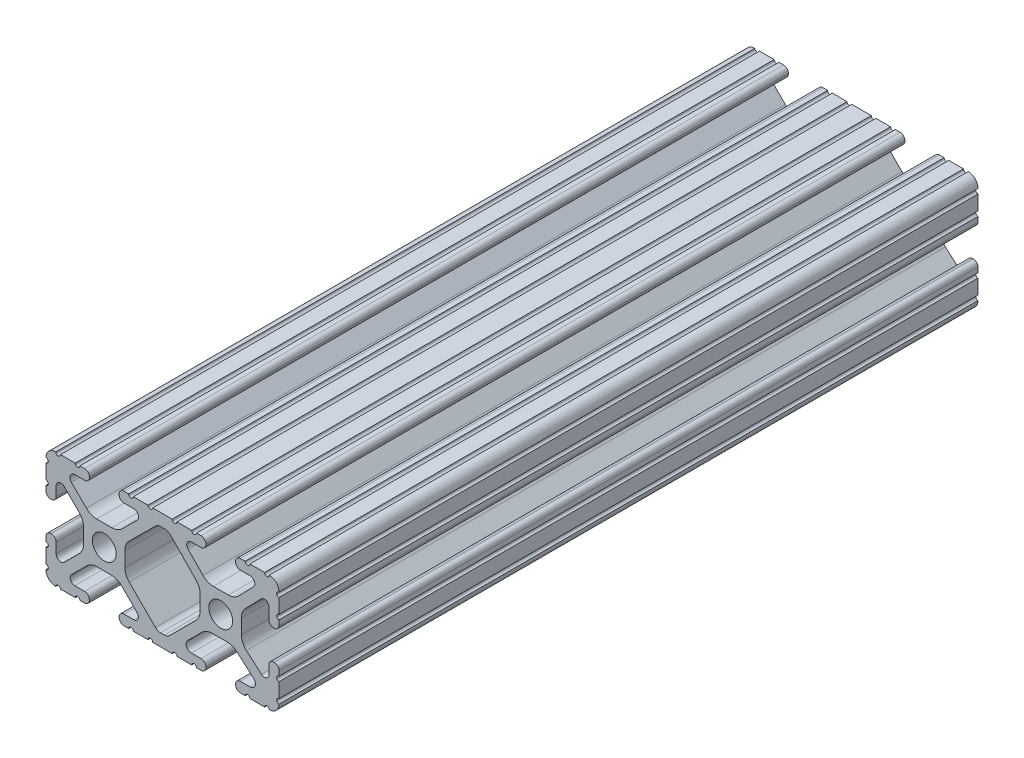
SolidWorks part; units mm, degrees
ref_plane "Front" through (0, 0, 0) normal (0, 0, 1) x (1, 0, 0)
ref_plane "Top" through (0, 0, 0) normal (0, 1, 0) x (1, 0, 0)
ref_plane "Right" through (0, 0, 0) normal (1, 0, 0) x (0, 0, -1)
sketch "Sketch1" plane through (0, 0, 0) normal (0, 0, 1) x (1, 0, 0)
  line L0 (-20.1324, -9.4742) -> (-5.2676, -9.4742) construction
  line L16 (-7.2595, -3.8694) -> (-1.5457, -9.5728)
  line L17 (-8.1915, 1.6223) -> (-8.1915, -1.6223)
  line L18 (-1.504, 9.5765) -> (-7.252, 3.8768)
  line L19 (0.5515, 10.033) -> (-0.3952, 10.033)
  line L20 (7.2829, 3.8459) -> (1.6756, 9.5611)
  line L21 (8.1915, -1.6223) -> (8.1915, 1.6223)
  line L22 (1.5457, -9.5728) -> (7.2595, -3.8694)
  line L23 (-0.4332, -10.033) -> (0.4332, -10.033)
  line L136 (18.0171, 12.7) -> (16.9875, 12.7)
  line L137 (15.9385, 11.651) -> (15.9385, 11.5392)
  line L138 (16.9875, 10.4902) -> (19.1164, 10.4902)
  line L139 (19.8441, 8.7652) -> (16.619, 5.4551)
  line L140 (14.3449, 4.4958) -> (11.0833, 4.4958)
  line L141 (8.817, 5.4472) -> (5.5642, 8.7627)
  line L142 (6.2894, 10.4902) -> (8.4125, 10.4902)
  line L143 (9.4615, 11.5392) -> (9.4615, 11.651)
  line L144 (8.4125, 12.7) -> (7.3829, 12.7)
  line L145 (6.3669, 12.7) -> (3.1496, 12.7)
  line L146 (2.1336, 12.7) -> (-2.1336, 12.7)
  line L147 (-3.1496, 12.7) -> (-6.3669, 12.7)
  line L148 (-7.3829, 12.7) -> (-8.4125, 12.7)
  line L149 (-9.4615, 11.651) -> (-9.4615, 11.5392)
  line L150 (-8.4125, 10.4902) -> (-6.2836, 10.4902)
  line L151 (-5.5326, 8.6661) -> (-8.81, 5.4163)
  line L152 (-11.0455, 4.4958) -> (-14.3545, 4.4958)
  line L153 (-16.59, 5.4163) -> (-19.8674, 8.6661)
  line L154 (-19.1164, 10.4902) -> (-16.9875, 10.4902)
  line L155 (-15.9385, 11.5392) -> (-15.9385, 11.651)
  line L156 (-16.9875, 12.7) -> (-18.0171, 12.7)
  line L157 (-19.0331, 12.7) -> (-22.2504, 12.7)
  line L158 (-25.4, 9.5504) -> (-25.4, 6.3331)
  line L159 (-25.4, 5.3171) -> (-25.4, 4.2375)
  line L160 (-24.401, 3.2385) -> (-24.2392, 3.2385)
  line L161 (-23.1902, 4.2875) -> (-23.1902, 6.3347)
  line L162 (-21.434, 7.0665) -> (-18.148, 3.8082)
  line L163 (-17.2085, 1.5536) -> (-17.2085, -1.6952)
  line L164 (-18.1405, -3.9423) -> (-21.4316, -7.2274)
  line L165 (-23.1902, -6.498) -> (-23.1902, -4.2875)
  line L166 (-24.2392, -3.2385) -> (-24.351, -3.2385)
  line L167 (-25.4, -4.2875) -> (-25.4, -5.3171)
  line L168 (-25.4, -6.3331) -> (-25.4, -9.5504)
  line L169 (-22.2504, -12.7) -> (-19.0331, -12.7)
  line L170 (-18.0171, -12.7) -> (-16.9875, -12.7)
  line L171 (-15.9384, -11.651) -> (-15.9384, -11.5392)
  line L172 (-16.9875, -10.4902) -> (-19.1164, -10.4902)
  line L173 (-19.8341, -8.7551) -> (-16.4966, -5.4237)
  line L174 (-14.2536, -4.4958) -> (-11.1464, -4.4958)
  line L175 (-8.9034, -5.4237) -> (-5.5659, -8.7551)
  line L176 (-6.2836, -10.4902) -> (-8.4125, -10.4902)
  line L177 (-9.4616, -11.5392) -> (-9.4616, -11.651)
  line L178 (-8.4125, -12.7) -> (-7.3829, -12.7)
  line L179 (-6.3669, -12.7) -> (-3.1496, -12.7)
  line L180 (-2.1336, -12.7) -> (2.1336, -12.7)
  line L181 (3.1496, -12.7) -> (6.3669, -12.7)
  line L182 (7.3829, -12.7) -> (8.4125, -12.7)
  line L183 (9.4616, -11.651) -> (9.4616, -11.5392)
  line L184 (8.4125, -10.4902) -> (6.2894, -10.4902)
  line L185 (5.4807, -8.5353) -> (8.5979, -5.4237)
  line L186 (10.8409, -4.4958) -> (14.1026, -4.4958)
  line L187 (16.1879, -5.2766) -> (19.8682, -8.4822)
  line L188 (19.1164, -10.4902) -> (16.9875, -10.4902)
  line L189 (15.9384, -11.5392) -> (15.9384, -11.651)
  line L190 (16.9875, -12.7) -> (18.0171, -12.7)
  line L191 (19.0331, -12.7) -> (22.2504, -12.7)
  line L192 (25.4, -9.5504) -> (25.4, -6.3331)
  line L193 (25.4, -5.3171) -> (25.4, -4.2375)
  line L194 (24.401, -3.2385) -> (24.1892, -3.2385)
  line L195 (23.1902, -4.2375) -> (23.1902, -6.1559)
  line L196 (21.584, -6.8869) -> (18.2982, -4.025)
  line L197 (17.2085, -1.6308) -> (17.2085, 1.6308)
  line L198 (18.1094, 3.8465) -> (21.5263, 7.3534)
  line L199 (23.1902, 6.6769) -> (23.1902, 4.2375)
  line L200 (24.1892, 3.2385) -> (24.401, 3.2385)
  line L201 (25.4, 4.2375) -> (25.4, 5.3171)
  line L202 (25.4, 6.3332) -> (25.4, 9.5504)
  line L203 (22.2504, 12.7) -> (19.0331, 12.7)
  circle A2 centre (-12.7, 0) radius 2.6035
  circle A4 centre (12.7, 0) radius 2.6035
  arc A18 (-1.5457, -9.5728) -> (-0.4332, -10.033) centre (-0.4332, -8.4582) ccw
  arc A19 (-8.1915, -1.6223) -> (-7.2595, -3.8694) centre (-5.0165, -1.6223) ccw
  arc A20 (-7.252, 3.8768) -> (-8.1915, 1.6223) centre (-5.0165, 1.6223) ccw
  arc A21 (-0.3952, 10.033) -> (-1.504, 9.5765) centre (-0.3952, 8.4582) ccw
  arc A22 (1.6756, 9.5611) -> (0.5515, 10.033) centre (0.5515, 8.4582) ccw
  arc A23 (8.1915, 1.6223) -> (7.2829, 3.8459) centre (5.0165, 1.6223) ccw
  arc A24 (7.2595, -3.8694) -> (8.1915, -1.6223) centre (5.0165, -1.6223) ccw
  arc A25 (0.4332, -10.033) -> (1.5457, -9.5728) centre (0.4332, -8.4582) ccw
  arc A152 (18.0171, 12.7) -> (19.0331, 12.7) centre (18.5251, 12.7) ccw
  arc A153 (16.9875, 12.7) -> (15.9385, 11.651) centre (16.9875, 11.651) ccw
  arc A154 (15.9385, 11.5392) -> (16.9875, 10.4902) centre (16.9875, 11.5392) ccw
  arc A155 (19.8441, 8.7652) -> (19.1164, 10.4902) centre (19.1164, 9.4742) ccw
  arc A156 (14.3449, 4.4958) -> (16.619, 5.4551) centre (14.3449, 7.6708) ccw
  arc A157 (8.817, 5.4472) -> (11.0833, 4.4958) centre (11.0833, 7.6708) ccw
  arc A158 (6.2894, 10.4902) -> (5.5642, 8.7627) centre (6.2894, 9.4742) ccw
  arc A159 (8.4125, 10.4902) -> (9.4615, 11.5392) centre (8.4125, 11.5392) ccw
  arc A160 (9.4615, 11.651) -> (8.4125, 12.7) centre (8.4125, 11.651) ccw
  arc A161 (6.3669, 12.7) -> (7.3829, 12.7) centre (6.8749, 12.7) ccw
  arc A162 (2.1336, 12.7) -> (3.1496, 12.7) centre (2.6416, 12.7) ccw
  arc A163 (-3.1496, 12.7) -> (-2.1336, 12.7) centre (-2.6416, 12.7) ccw
  arc A164 (-7.3829, 12.7) -> (-6.3669, 12.7) centre (-6.8749, 12.7) ccw
  arc A165 (-8.4125, 12.7) -> (-9.4615, 11.651) centre (-8.4125, 11.651) ccw
  arc A166 (-9.4615, 11.5392) -> (-8.4125, 10.4902) centre (-8.4125, 11.5392) ccw
  arc A167 (-5.5326, 8.6661) -> (-6.2836, 10.4902) centre (-6.2836, 9.4235) ccw
  arc A168 (-11.0455, 4.4958) -> (-8.81, 5.4163) centre (-11.0455, 7.6708) ccw
  arc A169 (-16.59, 5.4163) -> (-14.3545, 4.4958) centre (-14.3545, 7.6708) ccw
  arc A170 (-19.1164, 10.4902) -> (-19.8674, 8.6661) centre (-19.1164, 9.4235) ccw
  arc A171 (-16.9875, 10.4902) -> (-15.9385, 11.5392) centre (-16.9875, 11.5392) ccw
  arc A172 (-15.9385, 11.651) -> (-16.9875, 12.7) centre (-16.9875, 11.651) ccw
  arc A173 (-19.0331, 12.7) -> (-18.0171, 12.7) centre (-18.5251, 12.7) ccw
  arc A174 (-23.2664, 12.6998) -> (-22.2504, 12.7) centre (-22.7584, 12.7) ccw
  arc A175 (-23.2664, 12.6998) -> (-25.3998, 10.5664) centre (-23.2918, 10.5918) ccw
  arc A176 (-25.4, 9.5504) -> (-25.3998, 10.5664) centre (-25.4, 10.0584) ccw
  arc A177 (-25.4, 5.3171) -> (-25.4, 6.3331) centre (-25.4, 5.8251) ccw
  arc A178 (-25.4, 4.2375) -> (-24.401, 3.2385) centre (-24.401, 4.2375) ccw
  arc A179 (-24.2392, 3.2385) -> (-23.1902, 4.2875) centre (-24.2392, 4.2875) ccw
  arc A180 (-21.434, 7.0665) -> (-23.1902, 6.3347) centre (-22.1596, 6.3347) ccw
  arc A181 (-17.2085, 1.5536) -> (-18.148, 3.8082) centre (-20.3835, 1.5536) ccw
  arc A182 (-18.1405, -3.9423) -> (-17.2085, -1.6952) centre (-20.3835, -1.6952) ccw
  arc A183 (-23.1902, -6.498) -> (-21.4316, -7.2274) centre (-22.1596, -6.498) ccw
  arc A184 (-23.1902, -4.2875) -> (-24.2392, -3.2385) centre (-24.2392, -4.2875) ccw
  arc A185 (-24.351, -3.2385) -> (-25.4, -4.2875) centre (-24.351, -4.2875) ccw
  arc A186 (-25.4, -6.3331) -> (-25.4, -5.3171) centre (-25.4, -5.8251) ccw
  arc A187 (-25.3998, -10.5664) -> (-25.4, -9.5504) centre (-25.4, -10.0584) ccw
  arc A188 (-25.3998, -10.5664) -> (-23.2664, -12.6998) centre (-23.2918, -10.5918) ccw
  arc A189 (-22.2504, -12.7) -> (-23.2664, -12.6998) centre (-22.7584, -12.7) ccw
  arc A190 (-18.0171, -12.7) -> (-19.0331, -12.7) centre (-18.5251, -12.7) ccw
  arc A191 (-16.9875, -12.7) -> (-15.9384, -11.651) centre (-16.9875, -11.651) ccw
  arc A192 (-15.9384, -11.5392) -> (-16.9875, -10.4902) centre (-16.9875, -11.5392) ccw
  arc A193 (-19.8341, -8.7551) -> (-19.1164, -10.4902) centre (-19.1164, -9.4742) ccw
  arc A194 (-14.2536, -4.4958) -> (-16.4966, -5.4237) centre (-14.2536, -7.6708) ccw
  arc A195 (-8.9034, -5.4237) -> (-11.1464, -4.4958) centre (-11.1464, -7.6708) ccw
  arc A196 (-6.2836, -10.4902) -> (-5.5659, -8.7551) centre (-6.2836, -9.4742) ccw
  arc A197 (-8.4125, -10.4902) -> (-9.4616, -11.5392) centre (-8.4125, -11.5392) ccw
  arc A198 (-9.4616, -11.651) -> (-8.4125, -12.7) centre (-8.4125, -11.651) ccw
  arc A199 (-6.3669, -12.7) -> (-7.3829, -12.7) centre (-6.8749, -12.7) ccw
  arc A200 (-2.1336, -12.7) -> (-3.1496, -12.7) centre (-2.6416, -12.7) ccw
  arc A201 (3.1496, -12.7) -> (2.1336, -12.7) centre (2.6416, -12.7) ccw
  arc A202 (7.3829, -12.7) -> (6.3669, -12.7) centre (6.8749, -12.7) ccw
  arc A203 (8.4125, -12.7) -> (9.4616, -11.651) centre (8.4125, -11.651) ccw
  arc A204 (9.4616, -11.5392) -> (8.4125, -10.4902) centre (8.4125, -11.5392) ccw
  arc A205 (5.4807, -8.5353) -> (6.2894, -10.4902) centre (6.2894, -9.3455) ccw
  arc A206 (10.8409, -4.4958) -> (8.5979, -5.4237) centre (10.8409, -7.6708) ccw
  arc A207 (16.1879, -5.2766) -> (14.1026, -4.4958) centre (14.1026, -7.6708) ccw
  arc A208 (19.1164, -10.4902) -> (19.8682, -8.4822) centre (19.1164, -9.3455) ccw
  arc A209 (16.9875, -10.4902) -> (15.9384, -11.5392) centre (16.9875, -11.5392) ccw
  arc A210 (15.9384, -11.651) -> (16.9875, -12.7) centre (16.9875, -11.651) ccw
  arc A211 (19.0331, -12.7) -> (18.0171, -12.7) centre (18.5251, -12.7) ccw
  arc A212 (23.2664, -12.6998) -> (22.2504, -12.7) centre (22.7584, -12.7) ccw
  arc A213 (23.2664, -12.6998) -> (25.3998, -10.5664) centre (23.2918, -10.5918) ccw
  arc A214 (25.4, -9.5504) -> (25.3998, -10.5664) centre (25.4, -10.0584) ccw
  arc A215 (25.4, -5.3171) -> (25.4, -6.3331) centre (25.4, -5.8251) ccw
  arc A216 (25.4, -4.2375) -> (24.401, -3.2385) centre (24.401, -4.2375) ccw
  arc A217 (24.1892, -3.2385) -> (23.1902, -4.2375) centre (24.1892, -4.2375) ccw
  arc A218 (21.584, -6.8869) -> (23.1902, -6.1559) centre (22.2207, -6.1559) ccw
  arc A219 (17.2085, -1.6308) -> (18.2982, -4.025) centre (20.3835, -1.6308) ccw
  arc A220 (18.1094, 3.8465) -> (17.2085, 1.6308) centre (20.3835, 1.6308) ccw
  arc A221 (23.1902, 6.6769) -> (21.5263, 7.3534) centre (22.2207, 6.6769) ccw
  arc A222 (23.1902, 4.2375) -> (24.1892, 3.2385) centre (24.1892, 4.2375) ccw
  arc A223 (24.401, 3.2385) -> (25.4, 4.2375) centre (24.401, 4.2375) ccw
  arc A224 (25.4, 6.3332) -> (25.4, 5.3171) centre (25.4, 5.8251) ccw
  arc A225 (25.3998, 10.5664) -> (25.4, 9.5504) centre (25.4, 10.0584) ccw
  arc A226 (25.3998, 10.5664) -> (23.2664, 12.6998) centre (23.2918, 10.5918) ccw
  arc A227 (22.2504, 12.7) -> (23.2664, 12.6998) centre (22.7584, 12.7) ccw
extrude "Boss-Extrude1" add sketch "Sketch1" along normal mid plane 152.4
